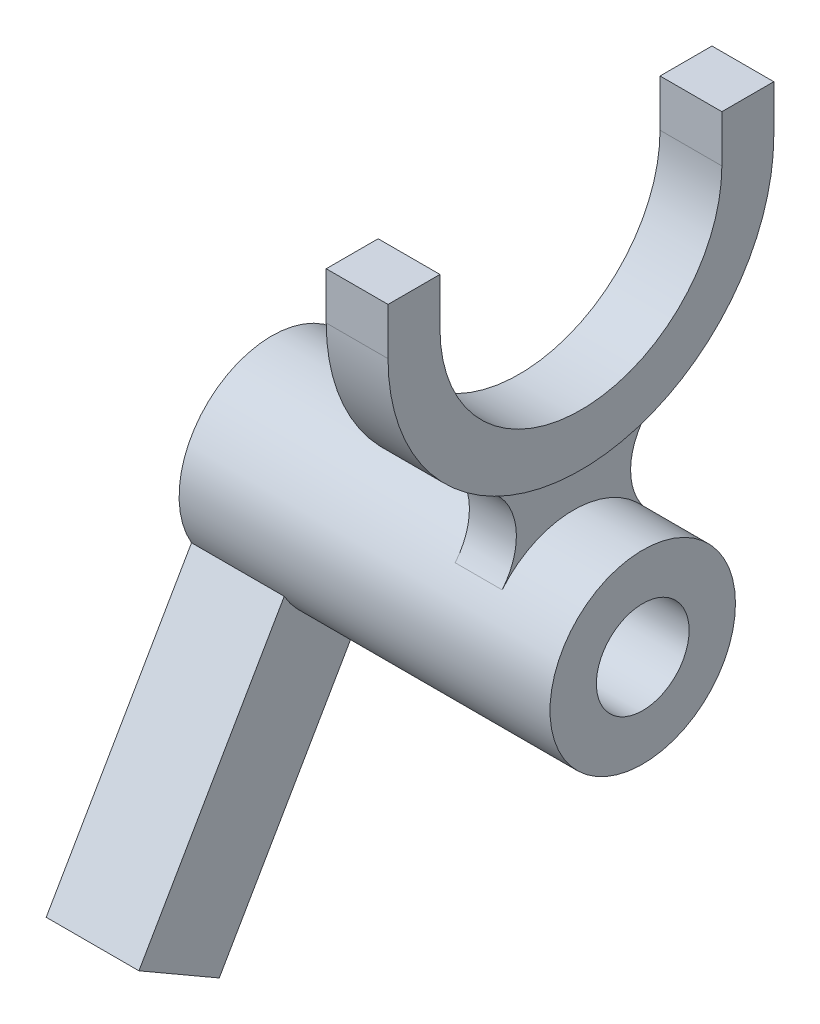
SolidWorks part; units mm, degrees
ref_plane "Front XY" through (0, 0, 0) normal (0, 0, 1) x (1, 0, 0)
ref_plane "Top XZ" through (0, 0, 0) normal (0, 1, 0) x (1, 0, 0)
ref_plane "Right YZ" through (0, 0, 0) normal (1, 0, 0) x (0, 0, -1)
sketch "Sketch1" plane through (0, 0, 0) normal (1, 0, 0) x (0, 0, -1)
  circle A0 centre (0, 0) radius 19.05
  circle A1 centre (0, 0) radius 9.525
  dimension "D1" = 38.1
  dimension "D2" = 19.05
extrude "Extrude1" add sketch "Sketch1" along normal blind 19.05 and the other way blind 57.15
sketch "Sketch2" plane through (0, 0, 0) normal (1, 0, 0) x (0, 0, -1)
  line L0 (0, 0) -> (0, 66.548) construction
  line L1 (39.624, 66.548) -> (39.624, 76.2)
  line L2 (-39.624, 66.548) -> (-39.624, 76.2)
  arc A0 (39.624, 66.548) -> (-39.624, 66.548) centre (0, 66.548) cw
  dimension "D2" = 39.624
  dimension "D1" = 9.652
  dimension "D3" = 66.548
extrude "Extrude-Thin1" add sketch "Sketch2" along normal mid plane 12.7 thin
sketch "Sketch3" plane through (0, 0, 0) normal (1, 0, 0) x (0, 0, -1)
  arc A0 (18.5011, 31.5085) -> (14.6586, 12.1667) centre (24.431, 20.2778) ccw
  arc A1 (-39.624, 66.548) -> (39.624, 66.548) centre (0, 66.548) ccw construction
  circle A2 centre (0, 0) radius 19.05 construction
  arc A3 (-18.5011, 31.5085) -> (-14.6586, 12.1667) centre (-24.431, 20.2778) cw
  arc A4 (-18.5011, 31.5085) -> (18.5011, 31.5085) centre (0, 66.548) ccw
  arc A5 (14.6586, 12.1667) -> (-14.6586, 12.1667) centre (0, 0) ccw
  dimension "D1" = 12.7
extrude "Extrude2" add sketch "Sketch3" along normal mid plane 9.652
sketch "Sketch4" [suppressed] plane through (0, 0, 0) normal (1, 0, 0) x (0, 0, -1)
  line L0 (0, 0) -> (-41.2718, -71.4849) construction
  line L1 (0, 41.91) -> (0, -41.91) construction
  dimension "D1" = 30
ref_plane "Plane1" [suppressed] through (0, 0, 0) normal (0, 0.5, 0.866) x (1, 0, 0)
sketch "Sketch5" [suppressed] plane through (0, 0, 0) normal (0, 0.5, 0.866) x (1, 0, 0)
  line L0 (-50.8, -76.2) -> (-38.1, -76.2)
  line L1 (-57.15, -9.525) -> (-38.1, -9.525)
  line L2 (-57.15, -9.525) -> (-57.15, -41.148)
  line L3 (-85.852, -76.2) -> (-73.152, -76.2)
  line L4 (-38.1, -9.525) -> (-38.1, -76.2)
  line L5 (-57.15, -41.148) -> (-85.852, -41.148)
  line L6 (-57.15, 0) -> (19.05, 0) construction
  line L7 (-73.152, -76.2) -> (-73.152, -58.42)
  line L8 (-85.852, -41.148) -> (-85.852, -76.2)
  line L9 (-73.152, -58.42) -> (-50.8, -58.42)
  line L10 (-50.8, -76.2) -> (-50.8, -58.42)
  line L11 (-57.15, 19.05) -> (-57.15, -19.05) construction
  line L12 (-57.15, -9.525) -> (19.05, -9.525) construction
  dimension "D1" = 19.05
  dimension "D2" = 41.148
  dimension "D3" = 35.052
  dimension "D4" = 22.352
  dimension "D5" = 47.752
  dimension "D6" = 12.7
  dimension "D7" = 17.78
extrude "Extrude3" [suppressed] add sketch "Sketch5" along normal mid plane 19.05
fillet "Fillet1" [suppressed] radius 3.048
fillet "Fillet2" [suppressed] radius 3.048
fillet "Fillet3" [suppressed] radius 3.048
sketch "Sketch6" plane through (-57.15, 0, 0) normal (-1, 0, 0) x (0, 0, 1)
  line L0 (0, 0) -> (38.1, -65.9911) construction
  line L1 (46.3489, -61.2286) -> (16.4978, -9.525)
  line L2 (46.3489, -61.2286) -> (29.8511, -70.7536)
  line L4 (29.8511, -70.7536) -> (0, -19.05)
  line L5 (0, 0) -> (0, -57.9832) construction
  circle A0 centre (0, 0) radius 19.05 construction
  arc A1 (0, -19.05) -> (16.4978, -9.525) centre (0, 0) ccw
  dimension "D1" = 19.05
  dimension "D2" = 76.2
  dimension "D3" = 30
extrude "Extrude4" add sketch "Sketch6" against normal blind 19.05
